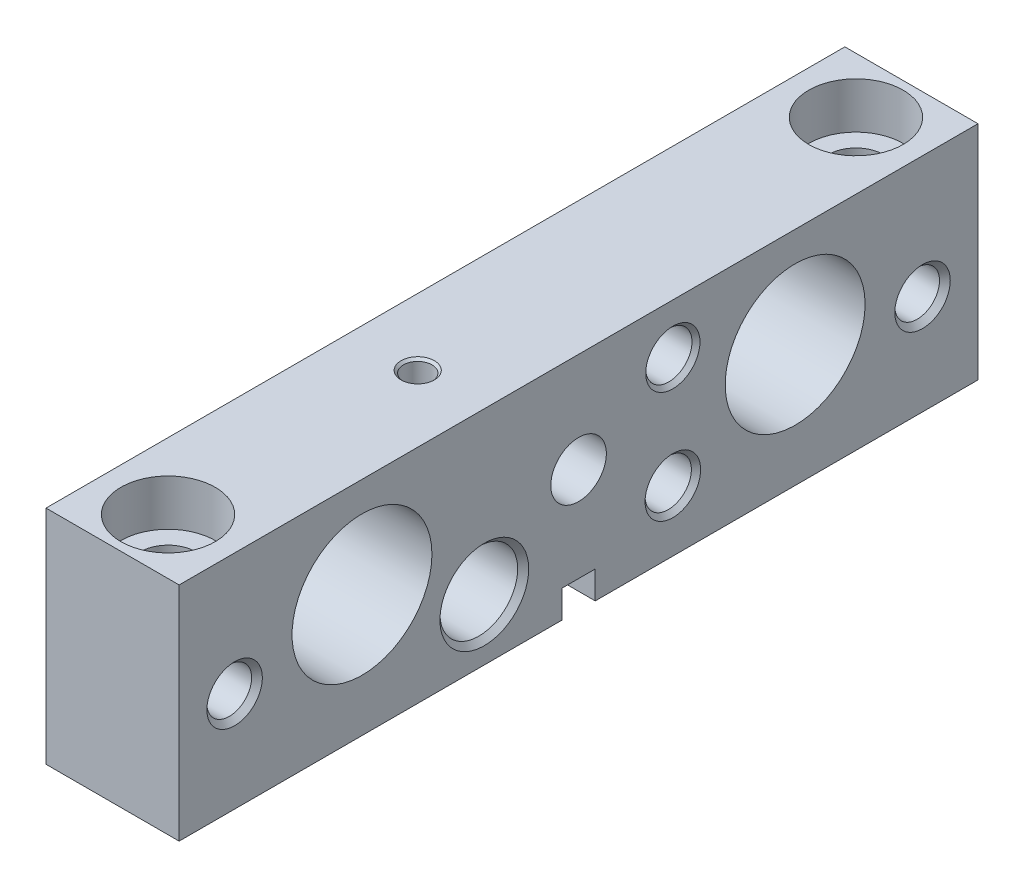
SolidWorks part; units mm, degrees
ref_plane "Front Plane" through (0, 0, 0) normal (0, 0, 1) x (1, 0, 0)
ref_plane "Top Plane" through (0, 0, 0) normal (0, 1, 0) x (1, 0, 0)
ref_plane "Right Plane" through (0, 0, 0) normal (1, 0, 0) x (0, 0, -1)
sketch "Sketch1" plane through (0, 0, 0) normal (1, 0, 0) x (0, 0, -1)
  line L0 (-57.15, -17.4498) -> (-2.3838, -17.4498)
  line L1 (-2.3838, -17.4498) -> (-2.3838, -13.4874)
  line L2 (-2.3838, -13.4874) -> (2.3838, -13.4874)
  line L3 (2.3838, -13.4874) -> (2.3838, -17.4498)
  line L4 (2.3838, -17.4498) -> (57.15, -17.4498)
  line L5 (57.15, -17.4498) -> (57.15, 14.3002)
  line L6 (57.15, 14.3002) -> (-57.15, 14.3002)
  line L7 (-57.15, 14.3002) -> (-57.15, -17.4498)
extrude "Extrude1" add sketch "Sketch1" along normal blind 19.05
ref_plane "Plane1" through (0, -17.4498, 0) normal (0, 1, 0) x (-1, 0, 0)
ref_plane "Plane2" through (0, -13.4874, 0) normal (0, 1, 0) x (-1, 0, 0)
sketch "Sketch2" plane through (0, -13.4874, 0) normal (0, 1, 0) x (-1, 0, 0)
  circle A0 centre (-9.525, 0) radius 2.3838
extrude "Cut-Extrude1" cut sketch "Sketch2" along normal blind 6.35
ref_plane "Plane3" through (0, -8.7122, 0) normal (0, 1, 0) x (-1, 0, 0)
sketch "Sketch3" plane through (0, -8.7122, 0) normal (0, 1, 0) x (-1, 0, 0)
  line L0 (-19.05, -13.4874) -> (-19.05, -9.5123)
  line L1 (-19.05, -9.5123) -> (-18.3896, -10.1727)
  line L2 (-18.3896, -10.1727) -> (-0.6604, -10.1727)
  line L3 (-0.6604, -10.1727) -> (0, -9.5123)
  line L4 (0, -9.5123) -> (0, -13.4874)
  line L5 (0, -13.4874) -> (-19.05, -13.4874)
  line L6 (0, -13.4874) -> (-19.05, -13.4874) construction
revolve "Cut-Revolve1" cut sketch "Sketch3" angle 360 about L6
ref_plane "Plane4" through (0, -8.7122, 0) normal (0, 1, 0) x (-1, 0, 0)
sketch "Sketch4" plane through (0, -8.7122, 0) normal (0, 1, 0) x (-1, 0, 0)
  line L0 (-19.05, 13.4874) -> (-19.05, 19.8374)
  line L1 (-19.05, 19.8374) -> (-18.2626, 19.05)
  line L2 (-18.2626, 19.05) -> (-0.7874, 19.05)
  line L3 (-0.7874, 19.05) -> (0, 19.8374)
  line L4 (0, 19.8374) -> (0, 13.4874)
  line L5 (0, 13.4874) -> (-19.05, 13.4874)
  line L6 (0, 13.4874) -> (-19.05, 13.4874) construction
revolve "Cut-Revolve2" cut sketch "Sketch4" angle 360 about L6
ref_plane "Plane5" through (0, 7.1628, 0) normal (0, 1, 0) x (-1, 0, 0)
sketch "Sketch5" plane through (0, 7.1628, 0) normal (0, 1, 0) x (-1, 0, 0)
  line L0 (-19.05, -13.4874) -> (-19.05, -9.6074)
  line L1 (-19.05, -9.6074) -> (-18.4795, -10.1779)
  line L2 (-18.4795, -10.1779) -> (-0.5705, -10.1779)
  line L3 (-0.5705, -10.1779) -> (0, -9.6074)
  line L4 (0, -9.6074) -> (0, -13.4874)
  line L5 (0, -13.4874) -> (-19.05, -13.4874)
  line L6 (0, -13.4874) -> (-19.05, -13.4874) construction
revolve "Cut-Revolve3" cut sketch "Sketch5" angle 360 about L6
ref_plane "Plane6" through (0, 0, 49.2125) normal (0, 0, 1) x (1, 0, 0)
ref_plane "Plane7" through (0, 0, -49.2125) normal (0, 0, 1) x (1, 0, 0)
sketch "Sketch6" plane through (0, 0, -49.2125) normal (0, 0, 1) x (1, 0, 0)
  line L0 (9.525, 14.3002) -> (16.2725, 14.3002)
  line L1 (16.2725, 14.3002) -> (16.2725, 7.6962)
  line L2 (16.2725, 7.6962) -> (13.4938, 7.6962)
  line L3 (13.4938, 7.6962) -> (13.4938, -17.4498)
  line L4 (13.4938, -17.4498) -> (9.525, -17.4498)
  line L5 (9.525, -17.4498) -> (9.525, 14.3002)
  line L6 (9.525, -17.4498) -> (9.525, 14.3002) construction
revolve "Cut-Revolve4" cut sketch "Sketch6" angle 360 about L6
sketch "Sketch7" plane through (0, 0, 49.2125) normal (0, 0, 1) x (1, 0, 0)
  line L0 (9.525, 14.3002) -> (16.2725, 14.3002)
  line L1 (16.2725, 14.3002) -> (16.2725, 7.6962)
  line L2 (16.2725, 7.6962) -> (13.4938, 7.6962)
  line L3 (13.4938, 7.6962) -> (13.4938, -17.4498)
  line L4 (13.4938, -17.4498) -> (9.525, -17.4498)
  line L5 (9.525, -17.4498) -> (9.525, 14.3002)
  line L6 (9.525, -17.4498) -> (9.525, 14.3002) construction
revolve "Cut-Revolve5" cut sketch "Sketch7" angle 360 about L6
ref_plane "Plane8" through (0, 0, -25.4) normal (0, 0, 1) x (1, 0, 0)
ref_plane "Plane9" through (0, 0, -19.05) normal (0, 0, 1) x (1, 0, 0)
ref_plane "Plane10" through (0, 0, 13.4874) normal (0, 0, 1) x (1, 0, 0)
ref_plane "Plane11" through (0, 0, 13.4874) normal (0, 0, 1) x (1, 0, 0)
sketch "Sketch8" plane through (0, 0, 13.4874) normal (0, 0, 1) x (1, 0, 0)
  line L0 (9.525, 14.3002) -> (11.9126, 14.3002)
  line L1 (11.9126, 14.3002) -> (11.5697, 13.9573)
  line L2 (11.5697, 13.9573) -> (11.5697, -3.4798)
  line L3 (11.5697, -3.4798) -> (9.525, -4.6603)
  line L4 (9.525, -4.6603) -> (9.525, 14.3002)
  line L5 (9.525, -4.6603) -> (9.525, 14.3002) construction
revolve "Cut-Revolve6" cut sketch "Sketch8" angle 360 about L5
ref_plane "Plane12" through (0, 0, 13.4874) normal (0, 0, 1) x (1, 0, 0)
ref_plane "Plane13" through (0, 0, 0) normal (1, 0, 0) x (0, 0, -1)
ref_plane "Plane14" through (9.525, 0, 0) normal (1, 0, 0) x (0, 0, -1)
ref_plane "Plane15" through (0, 0.0254, 0) normal (0, 1, 0) x (-1, 0, 0)
sketch "Sketch9" plane through (0, 0.0254, 0) normal (0, 1, 0) x (-1, 0, 0)
  line L0 (-19.05, 30.988) -> (-19.05, 40.9956)
  line L1 (-19.05, 40.9956) -> (0, 40.9956)
  line L2 (0, 40.9956) -> (0, 30.988)
  line L3 (0, 30.988) -> (-19.05, 30.988)
  line L4 (0, 30.988) -> (-19.05, 30.988) construction
sketch "Sketch10" plane through (0, 0.0254, 0) normal (0, 1, 0) x (-1, 0, 0)
  line L0 (-19.05, -30.988) -> (-19.05, -20.9804)
  line L1 (-19.05, -20.9804) -> (0, -20.9804)
  line L2 (0, -20.9804) -> (0, -30.988)
  line L3 (0, -30.988) -> (-19.05, -30.988)
  line L4 (0, -30.988) -> (-19.05, -30.988) construction
revolve "Cut-Revolve7" cut sketch "Sketch9" angle 360 about L4
revolve "Cut-Revolve8" cut sketch "Sketch10" angle 360 about L4
sketch "Sketch11" plane through (0, 0.0254, 0) normal (0, 1, 0) x (-1, 0, 0)
  line L0 (0, 0) -> (0, -2.413)
  line L1 (0, -2.413) -> (-0.4318, -1.9812)
  line L2 (-0.4318, -1.9812) -> (-9.0932, -1.9812)
  line L3 (-9.0932, -1.9812) -> (-9.525, -2.413)
  line L4 (-9.525, -2.413) -> (-9.525, -3.9751)
  line L5 (-9.525, -3.9751) -> (-19.05, -3.9751)
  line L6 (-19.05, -3.9751) -> (-19.05, 0)
  line L7 (-19.05, 0) -> (0, 0)
  line L8 (-19.05, 0) -> (0, 0) construction
revolve "Cut-Revolve9" cut sketch "Sketch11" angle 360 about L8
ref_plane "Plane16" through (19.05, 0, 0) normal (1, 0, 0) x (0, 0, -1)
ref_plane "Plane17" through (19.05, 0, 0) normal (1, 0, 0) x (0, 0, -1)
ref_plane "Plane18" through (0, 0, 0) normal (1, 0, 0) x (0, 0, -1)
ref_plane "Plane19" through (0, -3.1496, 0) normal (0, 1, 0) x (-1, 0, 0)
sketch "Sketch12" plane through (0, -3.1496, 0) normal (0, 1, 0) x (-1, 0, 0)
  line L0 (-19.05, -49.2125) -> (-19.05, -45.2437)
  line L1 (-19.05, -45.2437) -> (-18.2816, -46.0121)
  line L2 (-18.2816, -46.0121) -> (-0.7683, -46.0121)
  line L3 (-0.7683, -46.0121) -> (0, -45.2437)
  line L4 (0, -45.2437) -> (0, -49.2125)
  line L5 (0, -49.2125) -> (-19.05, -49.2125)
  line L6 (0, -49.2125) -> (-19.05, -49.2125) construction
sketch "Sketch13" plane through (0, -3.1496, 0) normal (0, 1, 0) x (-1, 0, 0)
  line L0 (-19.05, 49.2125) -> (-19.05, 53.1812)
  line L1 (-19.05, 53.1812) -> (-18.2816, 52.4129)
  line L2 (-18.2816, 52.4129) -> (-0.7683, 52.4129)
  line L3 (-0.7683, 52.4129) -> (0, 53.1812)
  line L4 (0, 53.1812) -> (0, 49.2125)
  line L5 (0, 49.2125) -> (-19.05, 49.2125)
  line L6 (0, 49.2125) -> (-19.05, 49.2125) construction
revolve "Cut-Revolve10" cut sketch "Sketch12" angle 360 about L6
revolve "Cut-Revolve11" cut sketch "Sketch13" angle 360 about L6
